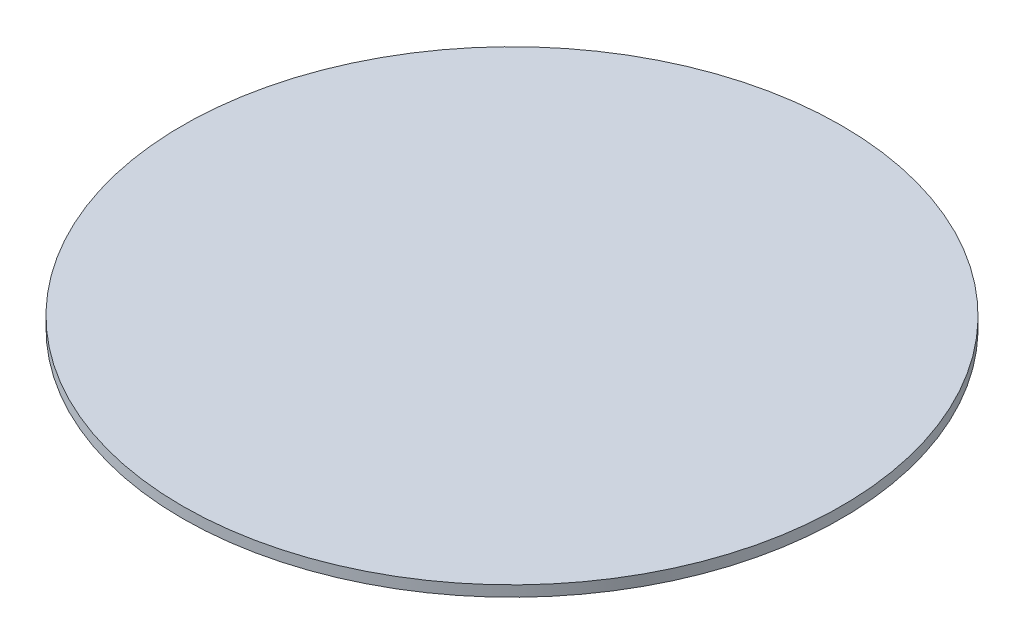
SolidWorks part; units mm, degrees
ref_plane "Front Plane" through (0, 0, 0) normal (0, 0, 1) x (1, 0, 0)
ref_plane "Top Plane" through (0, 0, 0) normal (0, 1, 0) x (1, 0, 0)
ref_plane "Right Plane" through (0, 0, 0) normal (1, 0, 0) x (0, 0, -1)
sketch "Sketch1" plane through (0, 0, 0) normal (0, 0, 1) x (1, 0, 0)
  line L0 (0, 0) -> (0, 165.6862) construction
  line L1 (-155.575, 0) -> (-155.575, 5.08)
  line L2 (-155.575, 5.08) -> (0, 5.08)
  line L3 (0, 5.08) -> (0, 0)
  line L4 (-119.38, -12.7) -> (-127, -12.7)
  line L5 (-127, -12.7) -> (-127, 0)
  line L6 (-127, 0) -> (-155.575, 0)
  line L7 (-119.38, -12.7) -> (-119.38, -10.16)
  line L8 (-109.22, 0) -> (0, 0)
  arc A0 (-119.38, -10.16) -> (-109.22, 0) centre (-109.22, -10.16) cw
  dimension "D7" = 10.16
  dimension "D1" = 254
  dimension "D2" = 5.08
  dimension "D3" = 12.7
  dimension "D4" = 311.15
  dimension "D5" = 7.62
  dimension "D6" = 5.08
revolve "Revolve1" add sketch "Sketch1" angle 360 about L0
